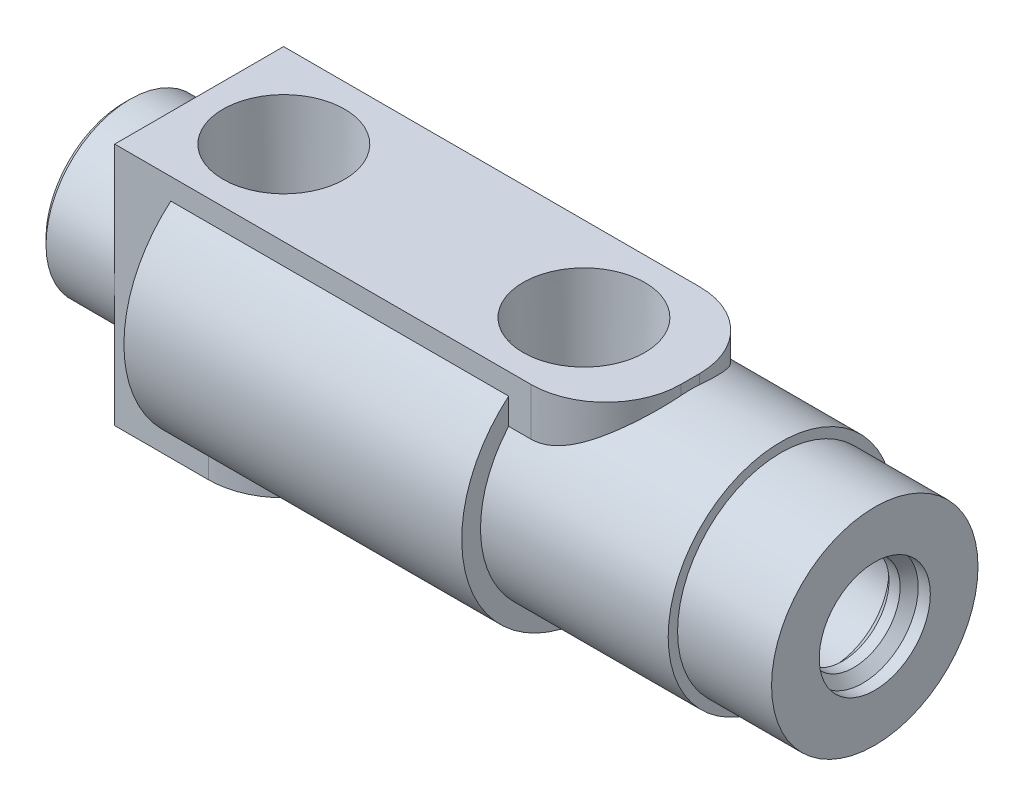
SolidWorks part; units mm, degrees
ref_plane "Front Plane" through (0, 0, 0) normal (0, 0, 1) x (1, 0, 0)
ref_plane "Top Plane" through (0, 0, 0) normal (0, 1, 0) x (1, 0, 0)
ref_plane "Right Plane" through (0, 0, 0) normal (1, 0, 0) x (0, 0, -1)
imported_body "Imported1"
hole_wizard "1/8 NPT Tapped Hole1" positions "Sketch1" profile "Sketch3" size "1/8" standard "ANSI Inch"
sketch "Sketch1" plane through (-63.5, 0, 0) normal (-1, 0, 0) x (0, 0, 1)
  point P0 (0, 0)
sketch "Sketch3" plane through (-63.5, 0, 0) normal (0, 1, 0) x (0, 0, 1)
  line L0 (0, 0) -> (0, 24.384)
  line L1 (4.2164, 24.384) -> (0, 24.384)
  line L2 (-4.2164, 24.384) -> (0, 24.384) construction
  line L3 (4.2164, 24.384) -> (4.2164, 6.9342)
  line L4 (4.2164, 6.9342) -> (4.9362, 6.9342)
  line L5 (4.9362, 6.9342) -> (5.1438, 0)
  line L6 (-4.9362, 6.9342) -> (-5.1438, 0) construction
  line L7 (5.1438, 0) -> (0, 0)
  line L8 (0, -6.35) -> (0, 107.95) construction
  line L11 (-4.2164, 6.9342) -> (-4.9362, 6.9342) construction
  dimension "Tap Drill Dia." = 8.4328
  dimension "Tap Drill Depth" = 24.384
  dimension "Thread Dia." = 10.2876
  dimension "Thread Angle" = 3.43
  dimension "Thread Depth" = 6.9342
  dimension "Drill Angle" = 180
hole_wizard "1/16 NPT Tapped Hole1" positions "Sketch4" profile "Sketch5" size "1/16" standard "ANSI Inch"
sketch "Sketch4" plane through (-39.116, 0, 0) normal (-1, 0, 0) x (0, 0, 1)
  point P0 (0, 0)
sketch "Sketch5" plane through (-39.116, 0, 0) normal (0, 1, 0) x (0, 0, 1)
  line L0 (0, 0) -> (0, 39.116)
  line L1 (0, 39.116) -> (3.0734, 39.116)
  line L2 (-3.7626, 6.8834) -> (-3.9687, 0) construction
  line L3 (3.0734, 39.116) -> (3.0734, 6.8834)
  line L4 (3.0734, 6.8834) -> (3.7626, 6.8834)
  line L5 (3.7626, 6.8834) -> (3.9687, 0)
  line L7 (3.9687, 0) -> (0, 0)
  line L8 (0, -6.35) -> (0, 107.95) construction
  line L11 (-3.0734, 6.8834) -> (-3.7626, 6.8834) construction
  dimension "Thru Tap Drill Dia." = 6.1468
  dimension "Thru Tap Drill Depth" = 39.116
  dimension "Thread Dia." = 7.9373
  dimension "Thread Angle" = 3.43
  dimension "Thread Depth" = 6.8834
